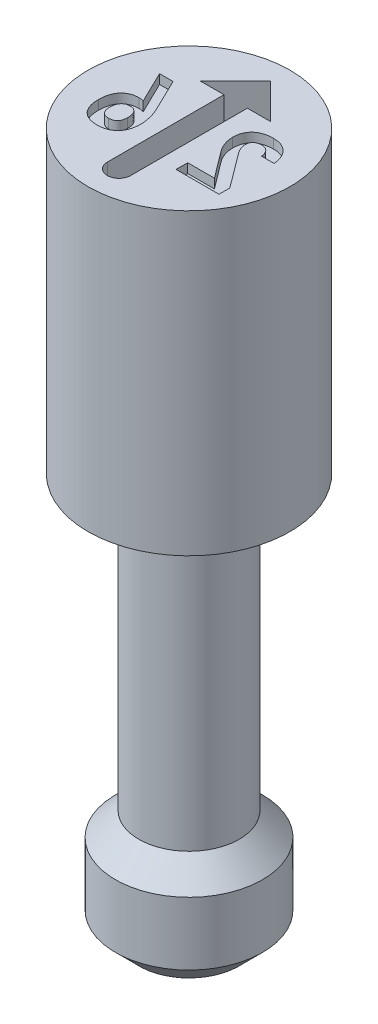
SolidWorks part; units mm, degrees
ref_plane "Front Plane" through (0, 0, 0) normal (0, 0, 1) x (1, 0, 0)
ref_plane "Top Plane" through (0, 0, 0) normal (0, 1, 0) x (1, 0, 0)
ref_plane "Right Plane" through (0, 0, 0) normal (1, 0, 0) x (0, 0, -1)
sketch "Sketch1" plane through (0, 0, 0) normal (0, 0, 1) x (1, 0, 0)
  line L0 (0, 7.62) -> (1.0986, 7.62)
  line L1 (0, -1.2084) -> (0, 1.2084) construction
  line L2 (1.0986, 7.62) -> (1.0986, 4.3688)
  line L3 (1.0986, 4.3688) -> (0.5461, 4.3688)
  line L4 (0.5461, 4.3688) -> (0.5461, 1.1938)
  line L5 (0.5461, 1.1938) -> (0.8, 0.9399)
  line L6 (0.8, 0.9399) -> (0.8, 0.254)
  line L7 (0.8, 0.254) -> (0.546, 0)
  line L8 (1.2084, 0) -> (-1.2084, 0) construction
  line L9 (0.546, 0) -> (0, 0)
  line L10 (0, 0) -> (0, 7.62)
  line L11 (0, 0) -> (0, 64.9194) construction
  dimension "D1" = 7.62
  dimension "D2" = 1.1938
  dimension "D3" = 0.254
  dimension "D4" = 45
  dimension "D5" = 1.6
  dimension "D6" = 2.1971
  dimension "D7" = 1.0922
  dimension "D8" = 3.2512
revolve "Revolve1" add sketch "Sketch1" angle 360 about L11
sketch "Sketch2" plane through (0, 7.62, 0) normal (0, 1, 0) x (1, 0, 0)
  line L1 (0.127, -0.762) -> (0.127, 0.508)
  line L2 (-0.127, -0.762) -> (-0.127, 0.508)
  line L3 (0, -1.2084) -> (0, 1.2084) construction
  line L4 (-0.127, 0.508) -> (-0.381, 0.508)
  line L5 (0.127, 0.508) -> (0.381, 0.508)
  line L6 (0.381, 0.508) -> (0, 0.889)
  line L7 (0, 0.889) -> (-0.381, 0.508)
  line L8 (-1.2084, 0) -> (1.2084, 0) construction
  arc A0 (-0.127, -0.762) -> (0.127, -0.762) centre (0, -0.762) ccw
  dimension "D6" = 0.762
  dimension "D1" = 0.254
  dimension "D3" = 0.762
  dimension "D4" = 0.381
  dimension "D5" = 45
  dimension "D7" = 0.508
extrude "Cut-Extrude1" cut sketch "Sketch2" against normal blind 0.4064
sketch "Sketch3" plane through (0, 7.62, 0) normal (0, 1, 0) x (1, 0, 0)
  text T0 "2 6" font "Bahnschrift SemiBold" height 0.8128
  dimension "D1" = 0.4572
extrude "Cut-Extrude2" cut sketch "Sketch3" against normal blind 0.1016
